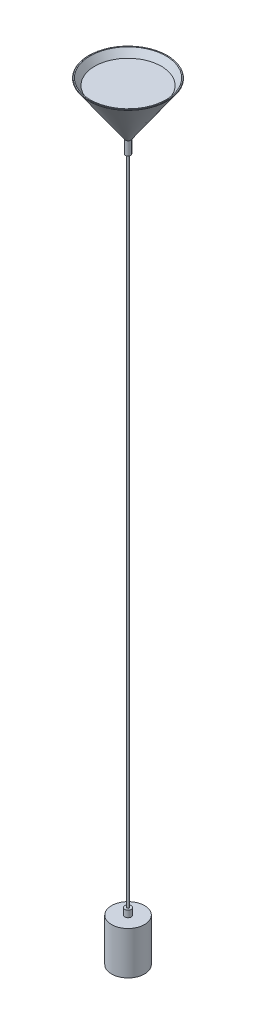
SolidWorks part; units mm, degrees
ref_plane "Alzado" through (0, 0, 0) normal (0, 0, 1) x (1, 0, 0)
ref_plane "Planta" through (0, 0, 0) normal (0, 1, 0) x (1, 0, 0)
ref_plane "Vista lateral" through (0, 0, 0) normal (1, 0, 0) x (0, 0, -1)
sketch "Croquis1" plane through (0, 0, 0) normal (0, 0, 1) x (1, 0, 0)
  line L0 (0, 0) -> (0, 80) construction
  line L2 (-60, 80) -> (0, 80)
  line L3 (0, 0) -> (-4, 0)
  line L4 (-4, 0) -> (-60, 80)
  line L5 (0, 0) -> (0, 80)
  dimension "D1" = 60
  dimension "D2" = 80
  dimension "D3" = 4
revolve "Revolución1" add sketch "Croquis1" angle 360 about L0
shell "Vaciado1" thickness 2
sketch "Croquis5" plane through (0, 0, 0) normal (0, 0, 1) x (1, 0, 0)
  line L0 (0, 0) -> (0, 70) construction
  line L1 (-4, 0) -> (4, 0) construction
  line L2 (50.8111, 70) -> (50.3736, 69.5)
  line L5 (0, 69.5) -> (50.3736, 69.5)
  line L9 (0, 70) -> (50.8111, 70)
  line L10 (0, 70) -> (0, 69.5)
  dimension "D1" = 70
  dimension "D2" = 0.5
revolve "Revolución2" add sketch "Croquis5" angle 360 about L0
fillet "Redondeo2" radius 0.5 1 edges at (0, 80, -60)
sketch "Croquis7" plane through (0, 0, 0) normal (0, -1, 0) x (1, 0, 0)
  circle A0 centre (0, 0) radius 4
extrude "Saliente-Extruir1" add sketch "Croquis7" along normal blind 20 separate body
sketch "Croquis8" plane through (0, -20, 0) normal (0, -1, 0) x (1, 0, 0)
  circle A0 centre (0, 0) radius 1.5
  dimension "D1" = 3
extrude "Saliente-Extruir2" add sketch "Croquis8" along normal blind 1000 separate body
sketch "Croquis9" plane through (0, -1020, 0) normal (0, -1, 0) x (1, 0, 0)
  circle A0 centre (0, 0) radius 25
  dimension "D1" = 50
extrude "Saliente-Extruir3" add sketch "Croquis9" along normal blind 65 separate body
sketch "Croquis10" plane through (0, -1020, 0) normal (0, 1, 0) x (1, 0, 0)
  circle A0 centre (0, 0) radius 5
  dimension "D1" = 10
extrude "Saliente-Extruir4" add sketch "Croquis10" along normal blind 10 separate body
